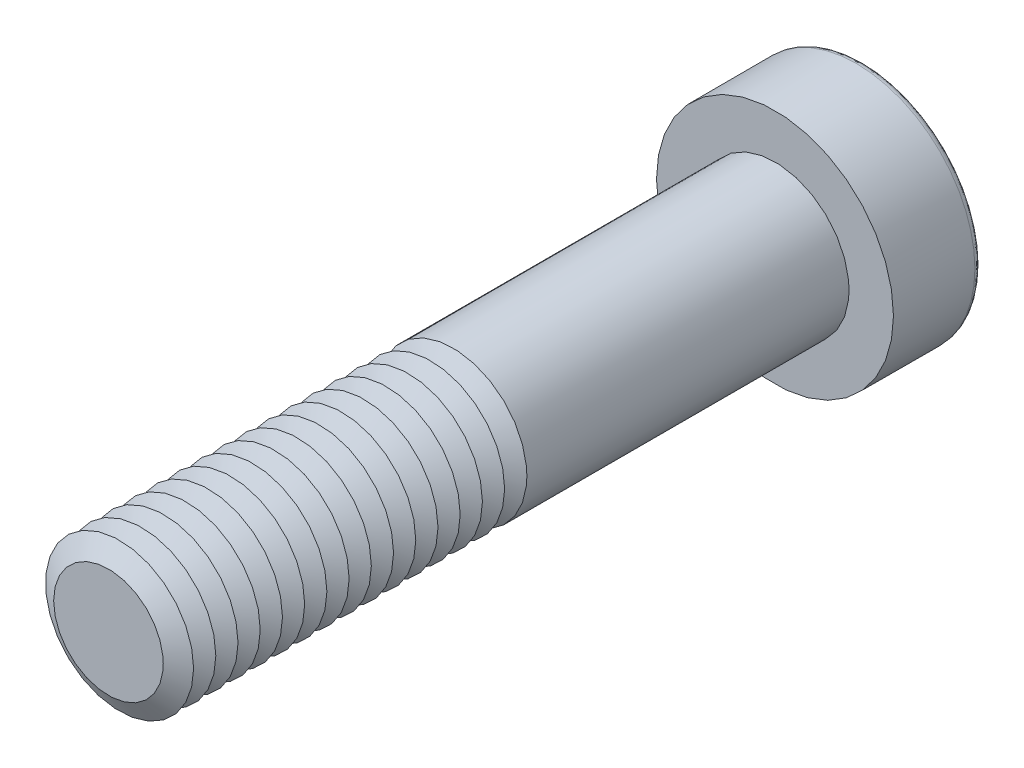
SolidWorks part; units mm, degrees
ref_plane "Front Plane" through (0, 0, 0) normal (0, 0, 1) x (1, 0, 0)
ref_plane "Top Plane" through (0, 0, 0) normal (0, 1, 0) x (1, 0, 0)
ref_plane "Right Plane" through (0, 0, 0) normal (1, 0, 0) x (0, 0, -1)
sketch "Sketch1" plane through (0, 0, 0) normal (0, 0, 1) x (1, 0, 0)
  circle A0 centre (0, 0) radius 5
  dimension "D1" = 10
extrude "Boss-Extrude1" add sketch "Sketch1" along normal blind 45
sketch "Sketch2" plane through (0, 0, 0) normal (0, 0, -1) x (-1, 0, 0)
  circle A0 centre (0, 0) radius 8
  dimension "D1" = 16
extrude "Boss-Extrude2" add sketch "Sketch2" along normal blind 6
sketch "Sketch3" plane through (0, 0, -6) normal (0, 0, -1) x (-1, 0, 0)
  line L1 (-2.0207, 3.5) -> (-4.0415, 0)
  line L2 (-4.0415, 0) -> (-2.0207, -3.5)
  line L3 (-2.0207, -3.5) -> (2.0207, -3.5)
  line L4 (2.0207, -3.5) -> (4.0415, 0)
  line L5 (4.0415, 0) -> (2.0207, 3.5)
  line L6 (2.0207, 3.5) -> (-2.0207, 3.5)
  circle A0 centre (0, 0) radius 3.5 construction
  dimension "D1" = 7
extrude "Cut-Extrude1" cut sketch "Sketch3" against normal blind 5.25
fillet "Fillet1" radius 0.5 1 edges at (-8, 0, -6)
sketch "Sketch4" plane through (0, 0, -0.75) normal (0, 0, -1) x (-1, 0, 0)
  line L0 (2.0207, -3.5) -> (4.0415, 0) construction
  circle A0 centre (0, 0) radius 3.5
extrude "Cut-Extrude2" cut sketch "Sketch4" against normal through all draft 60
sketch "Sketch5" plane through (0, 0, -6) normal (0, 0, -1) x (-1, 0, 0)
  circle A0 centre (0, 0) radius 4.0415
extrude "Cut-Extrude3" cut sketch "Sketch5" against normal through all draft 75
sketch "Sketch7" plane through (0, 0, 0) normal (1, 0, 0) x (0, 0, -1)
  line L25 (-45, 3.701) -> (-44.25, 5)
  line L26 (-45, 5) -> (-45, -5) construction
  line L27 (-44.25, 5) -> (-45.75, 5)
  line L28 (-45.75, 5) -> (-45, 3.701)
  line L29 (0, 5) -> (-45, 5) construction
  dimension "D1" = 1.5
revolve "Cut-Revolve1" cut sketch "Sketch7" angle 360 about axis through (0, 0, 45) along (0, 0, -1)
pattern_linear "LPattern1" count 16 spacing 1.5 along (0, 0, -1) of "Cut-Revolve1"
